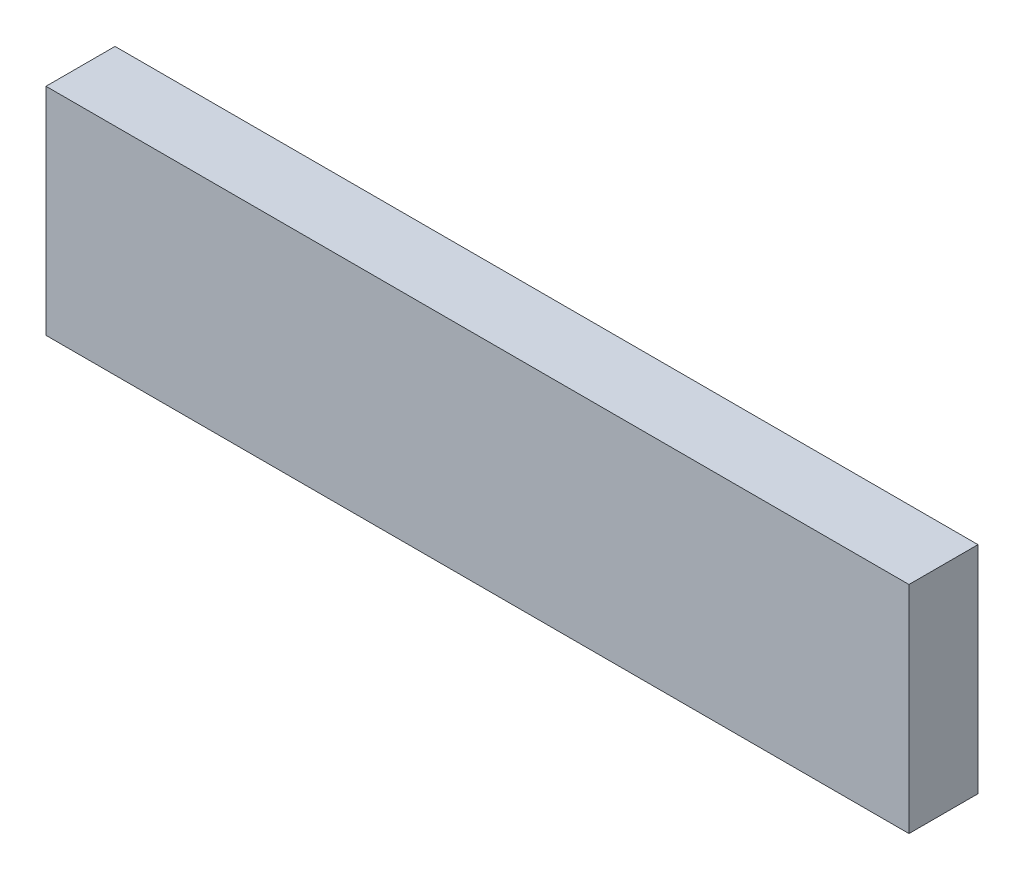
SolidWorks part; units mm, degrees
ref_plane "Plan de face" through (0, 0, 0) normal (0, 0, 1) x (1, 0, 0)
ref_plane "Plan de dessus" through (0, 0, 0) normal (0, 1, 0) x (1, 0, 0)
ref_plane "Plan de droite" through (0, 0, 0) normal (1, 0, 0) x (0, 0, -1)
sketch "Esquisse1" plane through (0, 0, 0) normal (1, 0, 0) x (0, 0, -1)
  line L1 (0, 0) -> (8, 0)
  line L2 (0, 0) -> (0, 25)
  line L3 (0, 25) -> (8, 25)
  line L4 (8, 0) -> (8, 25)
  dimension "D1" = 25
  dimension "D2" = 8
extrude "Extrusion1" add sketch "Esquisse1" along normal blind 100
